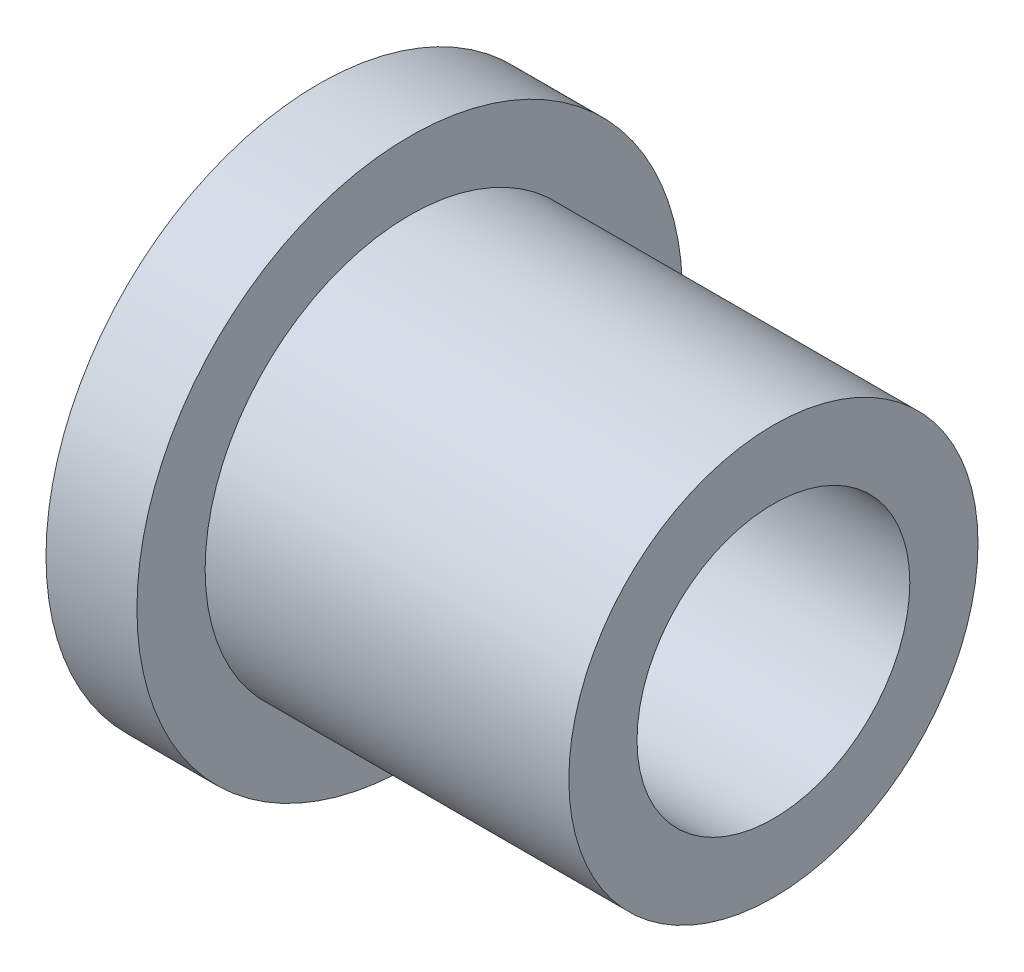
SolidWorks part; units mm, degrees
ref_plane "Front Plane" through (0, 0, 0) normal (0, 0, 1) x (1, 0, 0)
ref_plane "Top Plane" through (0, 0, 0) normal (0, 1, 0) x (1, 0, 0)
ref_plane "Right Plane" through (0, 0, 0) normal (1, 0, 0) x (0, 0, -1)
sketch "Sketch1" plane through (0, 0, 0) normal (0, 0, 1) x (1, 0, 0)
  line L0 (0, 0) -> (29.9331, 0) construction
  line L1 (0, 4.7625) -> (0, 9.525)
  line L2 (0, 9.525) -> (3.175, 9.525)
  line L3 (3.175, 9.525) -> (3.175, 7.1438)
  line L4 (3.175, 7.1438) -> (15.875, 7.1438)
  line L5 (15.875, 7.1438) -> (15.875, 4.7625)
  line L7 (15.875, 4.7625) -> (0, 4.7625)
  dimension "D1" = 9.525
  dimension "D2" = 14.2875
  dimension "D3" = 12.7
  dimension "D4" = 3.175
  dimension "D5" = 19.05
revolve "Revolve1" add sketch "Sketch1" angle 360 about L0
